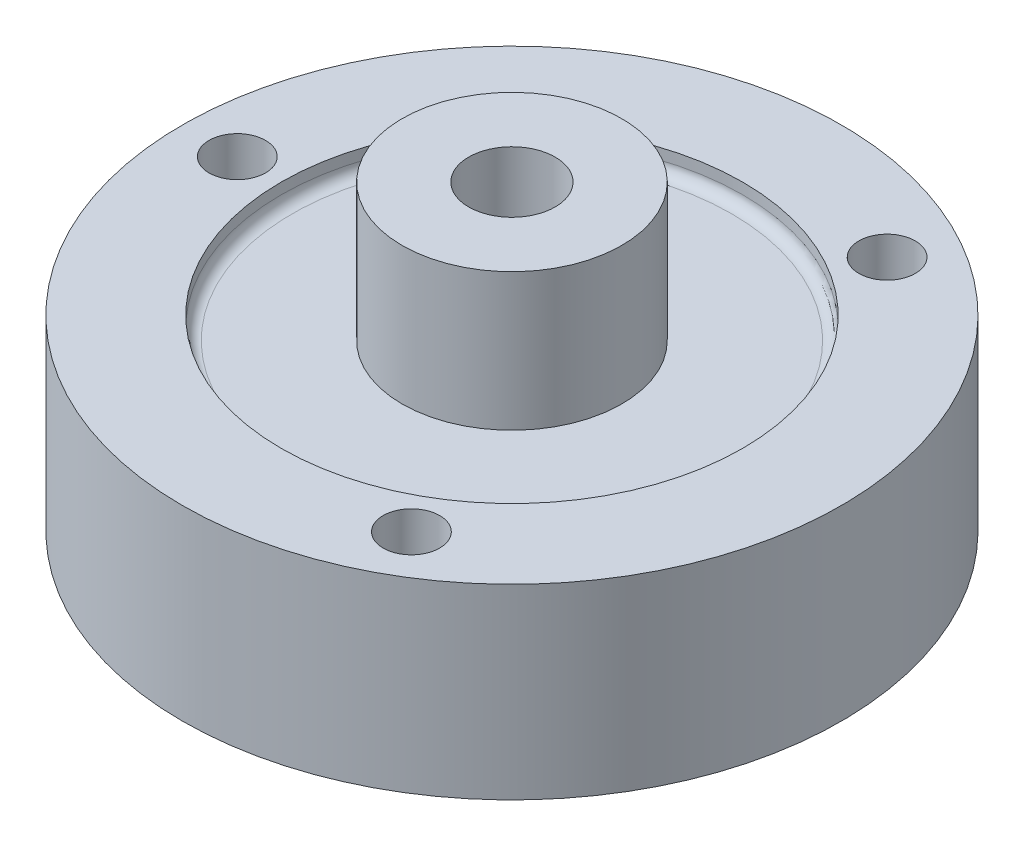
SolidWorks part; units mm, degrees
ref_plane "Front" through (0, 0, 0) normal (0, 0, 1) x (1, 0, 0)
ref_plane "Top" through (0, 0, 0) normal (0, 1, 0) x (1, 0, 0)
ref_plane "Right" through (0, 0, 0) normal (1, 0, 0) x (0, 0, -1)
sketch "Sketch1" plane through (0.0048, 0, -0.0439) normal (0, 1, 0) x (1, 0, 0)
  circle A0 centre (-0.0048, -0.0439) radius 19.05
  dimension "D1" = 38.1
extrude "Boss-Extrude1" add sketch "Sketch1" along normal blind 10.795
sketch "Sketch2" plane through (0, 0, 0) normal (0, -1, 0) x (1, 0, 0)
  circle A0 centre (0, 0) radius 5.715
  dimension "D1" = 11.43
extrude "Transducer force plate" add sketch "Sketch2" along normal blind 2.54
sketch "Sketch7" plane through (0, 10.795, 0) normal (0, 1, 0) x (1, 0, 0)
  circle A0 centre (0, 0) radius 13.335
  dimension "D1" = 26.67
extrude "Cut-Extrude2" cut sketch "Sketch7" against normal blind 1.27
fillet "Fillet1" radius 0.635 2 edges at (0, 9.525, 13.335) (0, 0, -5.715)
hole_wizard "#30 (0.1285) Diameter Hole1" positions "Sketch8" profile "Sketch9" hole size "#30" standard "ANSI Inch"
sketch "Sketch8" plane through (0, 10.795, 0) normal (0, 1, 0) x (1, 0, 0)
  circle A0 centre (0, 0) radius 15.875 construction
  point P0 (-15.875, 0)
  dimension "D1" = 31.75
sketch "Sketch9" plane through (-15.875, 10.795, 0) normal (1, 0, 0) x (0, 0, 1)
  line L0 (0, 0) -> (0, 13.335)
  line L1 (0, 13.335) -> (1.6319, 13.335)
  line L2 (1.6319, 13.335) -> (1.6319, 0)
  line L5 (1.6319, 0) -> (0, 0)
  line L11 (0, -6.35) -> (0, 107.95) construction
  dimension "Thru Hole Dia." = 3.2639
  dimension "Thru Hole Depth" = 13.335
pattern_circular "CirPattern1" count 3 over 360 about axis through (0, 0, 0) along (0, 1, 0) of "#30 (0.1285) Diameter Hole1"
hole_wizard "I (0.272) Diameter Hole1" positions "Sketch4" profile "Sketch6" hole size "I" standard "ANSI Inch"
sketch "Sketch4" plane through (0, 13.97, 0) normal (0, 1, 0) x (1, 0, 0)
  point P0 (0, 0)
sketch "Sketch6" plane through (0, 13.97, 0) normal (1, 0, 0) x (0, 0, 1)
  line L0 (0, 0) -> (0, 11.6006)
  line L1 (0, 11.6006) -> (3.4544, 9.525)
  line L2 (3.4544, 9.525) -> (3.4544, 0)
  line L5 (3.4544, 0) -> (0, 0)
  line L10 (0, 11.6006) -> (-3.4544, 9.525) construction
  line L11 (0, -6.35) -> (0, 107.95) construction
  dimension "Hole Dia." = 6.9088
  dimension "Hole Depth" = 9.525
  dimension "Drill Angle" = 118
sketch "Sketch3" plane through (0, -18.161, 0) normal (0, 0, 1) x (1, 0, 0)
  line L0 (0, 28.956) -> (0, 15.621) construction
  line L1 (19.05, 28.956) -> (-19.05, 28.956) construction
  line L2 (-5.715, 15.621) -> (5.715, 15.621) construction
  circle A0 centre (0, 23.876) radius 1.6002
  dimension "D1" = 3.2004
  dimension "D2" = 5.08
extrude "Pin Hole" [suppressed] cut sketch "Sketch3" against normal through all both and the other way through all
sketch "Sketch10" plane through (0, 9.525, 0) normal (0, 1, 0) x (1, 0, 0)
  circle A0 centre (0, 0) radius 6.35
  dimension "D1" = 12.7
extrude "Boss-Extrude2" add sketch "Sketch10" along normal blind 7.9375
hole_wizard "M6x1.0 Tapped Hole1" positions "Sketch11" profile "Sketch12" tap size "M6x1.0" standard "ANSI Metric"
sketch "Sketch11" plane through (0, 17.4625, 0) normal (0, 1, 0) x (1, 0, 0)
  point P0 (0, 0)
sketch "Sketch12" plane through (0, 17.4625, 0) normal (1, 0, 0) x (0, 0, 1)
  line L0 (0, 0) -> (0, 16.5021)
  line L1 (0, 16.5021) -> (2.5, 15)
  line L2 (2.5, 15) -> (2.5, 0)
  line L5 (2.5, 0) -> (0, 0)
  line L10 (0, 16.5021) -> (-2.5, 15) construction
  line L11 (0, -6.35) -> (0, 107.95) construction
  dimension "Tap Drill Dia." = 5
  dimension "Tap Drill Depth" = 15
  dimension "Drill Angle" = 118
